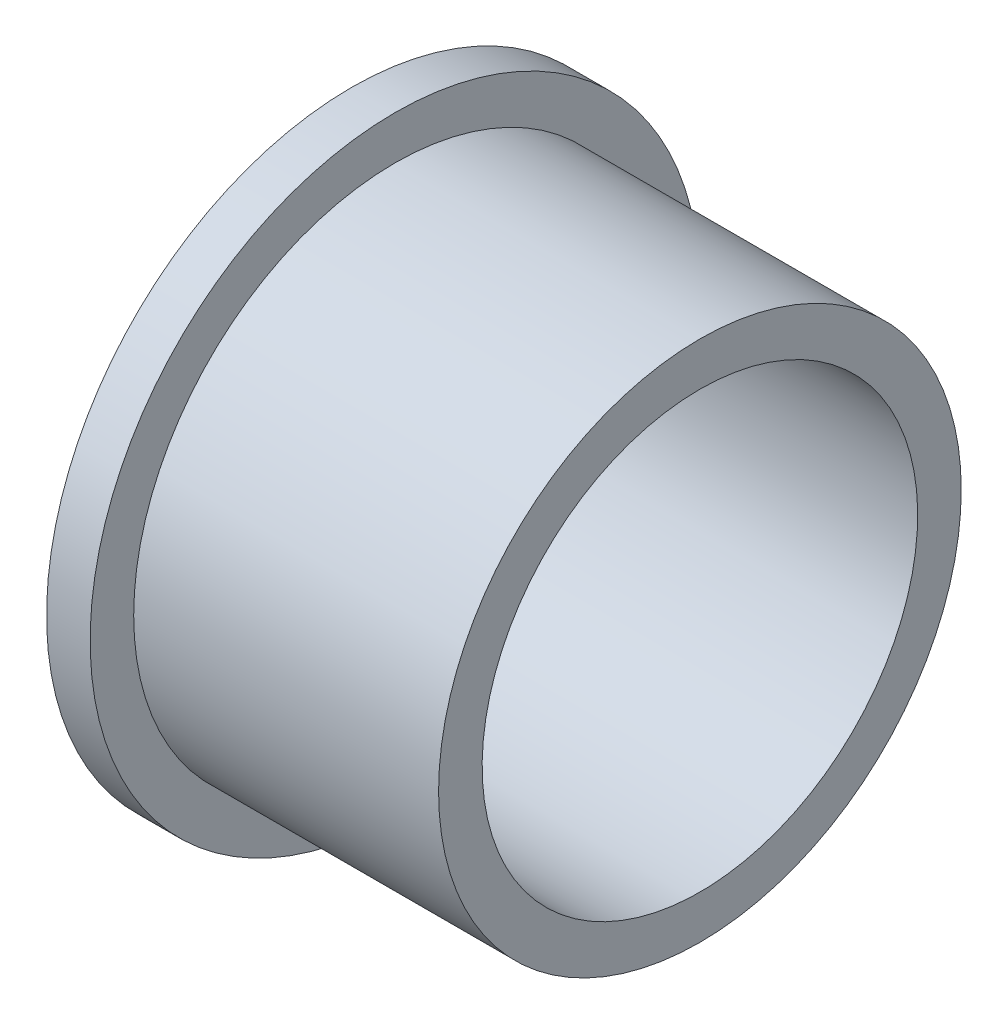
SolidWorks part; units mm, degrees
ref_plane "Piano frontale" through (0, 0, 0) normal (0, 0, 1) x (1, 0, 0)
ref_plane "Piano superiore" through (0, 0, 0) normal (0, 1, 0) x (1, 0, 0)
ref_plane "Piano destro" through (0, 0, 0) normal (1, 0, 0) x (0, 0, -1)
sketch "Schizzo1" plane through (0, 0, 0) normal (0, 0, 1) x (1, 0, 0)
  line L0 (0, 0) -> (-20, 0) construction
  line L1 (-20, 12.5) -> (-20, 17.5)
  line L2 (-20, 17.5) -> (-17.5, 17.5)
  line L3 (-17.5, 17.5) -> (-17.5, 15)
  line L4 (-17.5, 15) -> (0, 15)
  line L5 (0, 15) -> (0, 12.5)
  line L6 (0, 12.5) -> (-20, 12.5)
  point P10 (-18.75, 17.5)
  dimension "D1" = 25
  dimension "D2" = 2.5
  dimension "D3" = 17.5
  dimension "D4" = 2.5
  dimension "D5" = 35
revolve "Rivoluzione1" add sketch "Schizzo1" angle 360 about L0
sketch "Linee di piegatura1" [suppressed] plane through (0, 0, 0) normal (0, 1, 0) x (1, 0, 0)
sketch "Casella di contorno1" [suppressed] plane through (0, 0, 0) normal (0, 1, 0) x (1, 0, 0)
equation "\"Lam_vern\"= 2 * ( \"SW-Massa\" / \"SW-Densità\" ) / ( \"Spessore\" / 1000 )"
